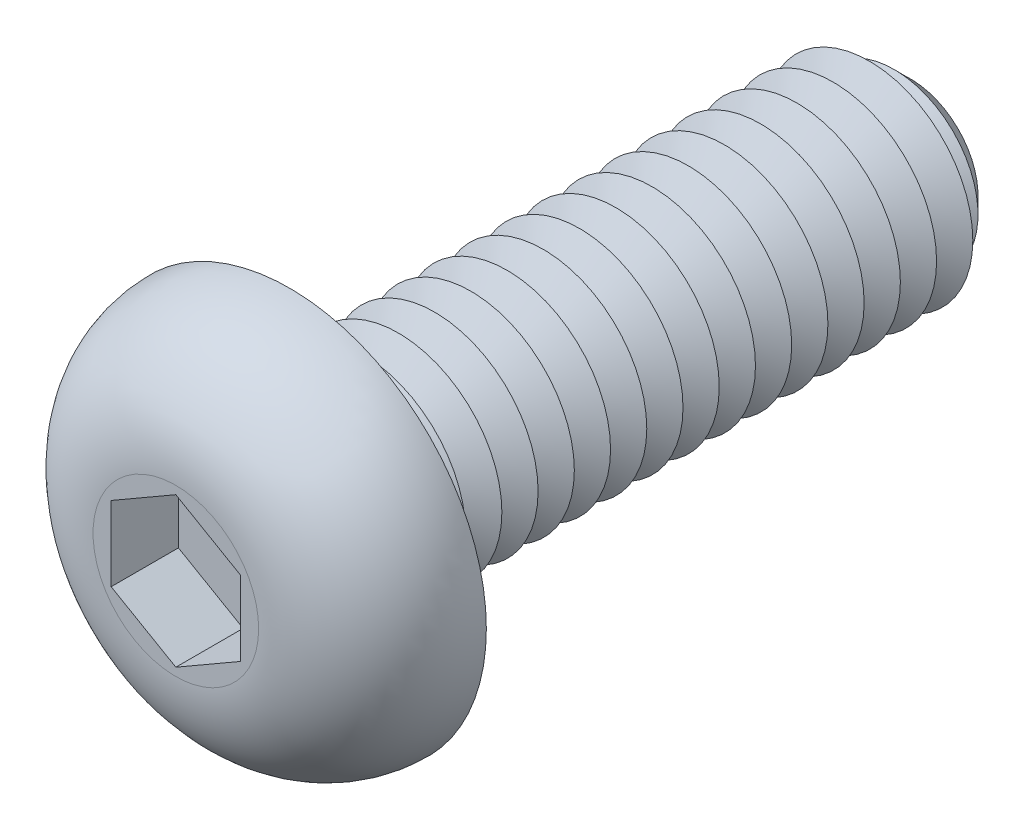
SolidWorks part; units mm, degrees
ref_plane "Front Plane" through (0, 0, 0) normal (0, 0, 1) x (1, 0, 0)
ref_plane "Top Plane" through (0, 0, 0) normal (0, 1, 0) x (1, 0, 0)
ref_plane "Right Plane" through (0, 0, 0) normal (1, 0, 0) x (0, 0, -1)
sketch "Sketch1" plane through (0, 0, 0) normal (1, 0, 0) x (0, 0, -1)
  line L0 (-47.9342, 0) -> (60.3146, 0) construction
sketch "Sketch2" plane through (0, 0, 0) normal (1, 0, 0) x (0, 0, -1)
  line L0 (0, 0) -> (-2.2, 0)
  line L1 (-47.9342, 0) -> (60.3146, 0) construction
  line L2 (-2.2, 0) -> (-2.2, 1.6)
  line L3 (0, 3.8) -> (0, 0)
  arc A0 (-2.2, 1.6) -> (0, 3.8) centre (0, 1.6) cw
  dimension "D1" = 2.2
  dimension "D2" = 2.2
  dimension "D3" = 3.8
revolve "Revolve1" add sketch "Sketch2" angle 360 about L0
sketch "Sketch3" plane through (0, 0, 2.2) normal (0, 0, 1) x (1, 0, 0)
  line L1 (0, 1.4434) -> (-1.25, 0.7217)
  line L2 (-1.25, 0.7217) -> (-1.25, -0.7217)
  line L3 (-1.25, -0.7217) -> (0, -1.4434)
  line L4 (0, -1.4434) -> (1.25, -0.7217)
  line L5 (1.25, -0.7217) -> (1.25, 0.7217)
  line L6 (1.25, 0.7217) -> (0, 1.4434)
  circle A0 centre (0, 0) radius 1.25 construction
  dimension "D1" = 2.5
extrude "Cut-Extrude1" cut sketch "Sketch3" against normal blind 1.3
sketch "Sketch4" plane through (0, 0, 0) normal (0, 0, -1) x (-1, 0, 0)
  circle A0 centre (0, 0) radius 2
  dimension "D1" = 4
extrude "Boss-Extrude1" add sketch "Sketch4" along normal blind 12
chamfer "Chamfer1" distance 0.7 angle 45 1 edges at (-2, 0, -12)
sketch "Sketch5" plane through (0, 0, 0) normal (1, 0, 0) x (0, 0, -1)
  line L0 (0.7, 2) -> (1.4, 2)
  line L1 (11.3, 2) -> (0, 2) construction
  line L2 (1.4, 2) -> (1.05, 1.3938)
  line L3 (1.05, 1.3938) -> (0.7, 2)
  line L4 (0, -3.8) -> (0, 3.8) construction
  line L5 (11.3, 2) -> (0, 2) construction
  dimension "D1" = 0.7
  dimension "D2" = 0.7
revolve "Cut-Revolve1" cut sketch "Sketch5" angle 360 about L0
pattern_linear "LPattern1" count 16 spacing 0.7 along (0, 0, -1) of "Cut-Revolve1"
fillet "Fillet2" radius 0.35 1 edges at (2, 0, 0)
sketch "Sketch6" plane through (0, 0, 0.9) normal (0, 0, 1) x (1, 0, 0)
  circle A0 centre (0, 0) radius 0.5
  dimension "D1" = 1
extrude "Cut-Extrude2" cut sketch "Sketch6" against normal up to surface (12.9 mm away)
